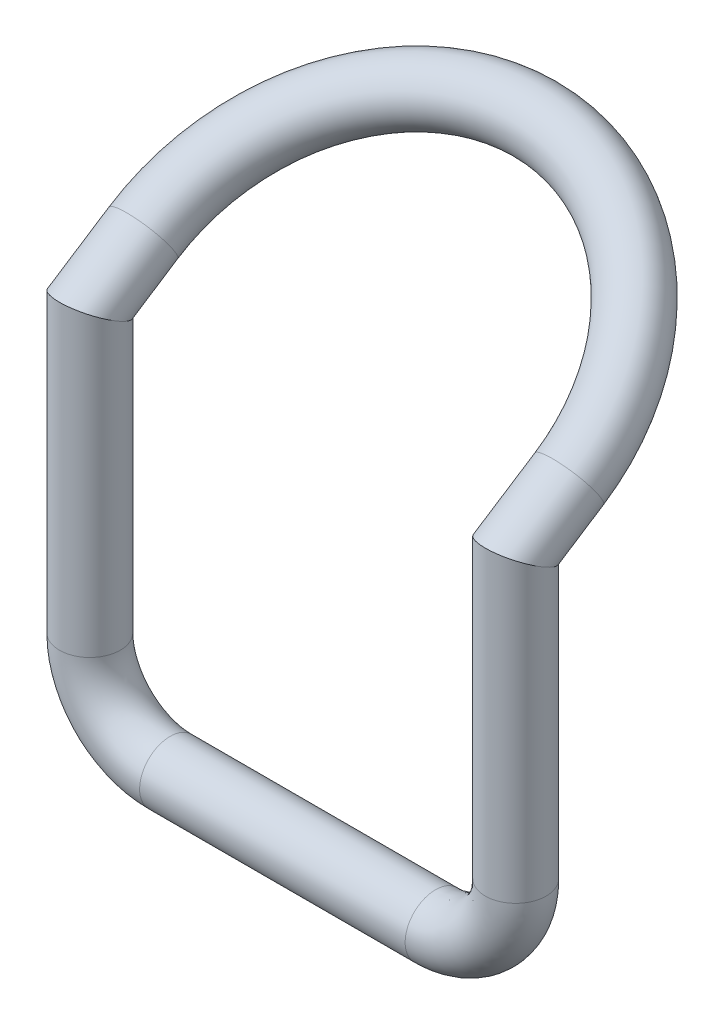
SolidWorks part; units mm, degrees
ref_plane "Front Plane" through (0, 0, 0) normal (0, 0, 1) x (1, 0, 0)
ref_plane "Top Plane" through (0, 0, 0) normal (0, 1, 0) x (1, 0, 0)
ref_plane "Plane" through (0, 0, 0) normal (1, 0, 0) x (0, 0, -1)
sketch3d "3DSketch1"
  line L0 (0, 0, 0) -> (0, -59.4642, 0)
  line L1 (16.7358, -76.2, 0) -> (72.1642, -76.2, 0)
  line L2 (88.9, -59.4642, 0) -> (88.9, 0, 0)
  line L3 (0, 0, 0) -> (0, 7.24, -11.171)
  line L4 (88.9, 0, 0) -> (88.9, 7.24, -11.171)
  arc A0 (0, 7.24, -11.171) -> (88.9, 7.24, -11.171) centre (44.45, 7.24, -11.171) ccw
  arc A1 (0, -59.4642, 0) -> (16.7358, -76.2, 0) centre (16.7358, -59.4642, 0) ccw
  arc A2 (72.1642, -76.2, 0) -> (88.9, -59.4642, 0) centre (72.1642, -59.4642, 0) ccw
  point P8 (44.45, -30.061, -35.3461)
  point P11 (0, -76.2, 0)
  point P12 (16.7358, -59.4642, 16.7358)
  point P15 (88.9, -76.2, 0)
  point P16 (72.1642, -59.4642, 16.7358)
  dimension "D1" = 88.9
  dimension "D3" = 44.45
  dimension "D2" = 76.2
ref_plane "Plane1" through (0, 0, 0) normal (0, -0.8392, -0.5439) x (1, 0, 0)
ref_plane " Plane2" through (0, -59.4642, 0) normal (0, 1, 0) x (-1, 0, 0)
sketch "Sketch1" plane through (0, -59.4642, 0) normal (0, 1, 0) x (-1, 0, 0)
  circle A0 centre (-88.9, 0) radius 6.35
  dimension "D1" = 12.7
sweep "Sweep1" add profiles "Sketch1" path "3DSketch1"
